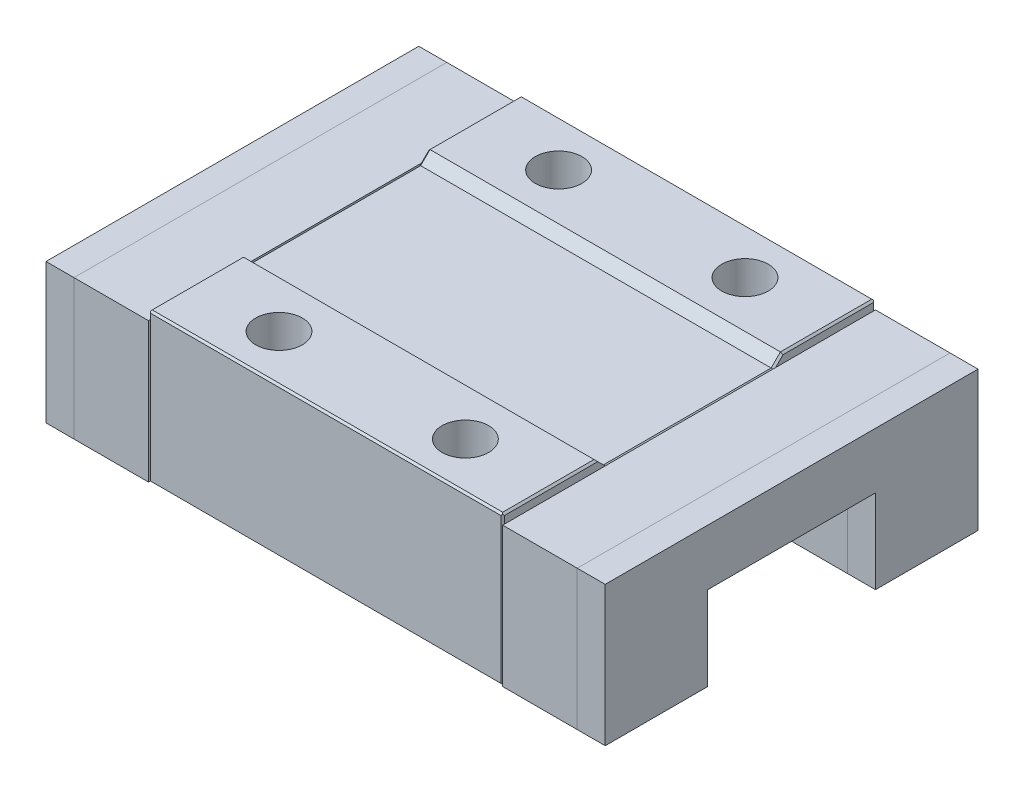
SolidWorks part; units mm, degrees
ref_plane "Ebene vorne" through (0, 0, 0) normal (0, 0, 1) x (1, 0, 0)
ref_plane "Ebene oben" through (0, 0, 0) normal (0, 1, 0) x (1, 0, 0)
ref_plane "Ebene rechts" through (0, 0, 0) normal (1, 0, 0) x (0, 0, -1)
sketch "Skizze1" plane through (0, 0, 0) normal (1, 0, 0) x (0, 0, -1)
  line L0 (0, 0) -> (0, -11.0826) construction
  line L1 (10, -4) -> (4.5, -4)
  line L2 (10, -4) -> (10, 4)
  line L3 (10, 4) -> (4.5, 4)
  line L4 (-10, -4) -> (-10, 4)
  line L5 (10, -4) -> (-10, 4) construction
  line L6 (10, 4) -> (-10, -4) construction
  line L7 (-4.5, -4) -> (-10, -4)
  line L8 (-4.5, 4) -> (-10, 4)
  line L9 (-4.5, -4) -> (-4.5, 0.5)
  line L10 (-4.5, 0.5) -> (4.5, 0.5)
  line L11 (4.5, -4) -> (4.5, 0.5)
  line L13 (4.5, 4) -> (4.5, 3.5)
  line L14 (4.5, 3.5) -> (-4.5, 3.5)
  line L15 (-4.5, 4) -> (-4.5, 3.5)
  point P0 (0, 0)
  dimension "D1" = 8
  dimension "D2" = 20
  dimension "D3" = 4.5
  dimension "D4" = 9
  dimension "D5" = 4.5
  dimension "D6" = 0.5
  dimension "D8" = 4.5
extrude "Aufsatz-Linear austragen1" add sketch "Skizze1" against normal blind 19
sketch "Skizze6" plane through (0, 4, 0) normal (0, 1, 0) x (1, 0, 0)
  line L0 (-9.5, 10) -> (-9.5, -10) construction
  line L1 (-14.5, 7.5) -> (-4.5, 7.5) construction
  line L2 (-14.5, 7.5) -> (-14.5, -7.5) construction
  line L3 (-14.5, -7.5) -> (-4.5, -7.5) construction
  line L4 (-4.5, 7.5) -> (-4.5, -7.5) construction
  line L5 (-19, 10) -> (0, 10) construction
  line L6 (-19, -10) -> (0, -10) construction
  point P12 (-14.5, 7.5)
  point P13 (-4.5, 7.5)
  point P14 (-4.5, -7.5)
  point P15 (-14.5, -7.5)
  dimension "D1" = 5
  dimension "D2" = 10
  dimension "D3" = 7.5
  dimension "D4" = 15
sketch "Skizze3" plane through (0, 0, 0) normal (1, 0, 0) x (0, 0, -1)
  line L0 (-4.5, 4) -> (-10, 4) construction
  line L12 (-4.5, 4) -> (-10, 4)
  line L13 (-10, 4) -> (-10, -4)
  line L14 (-10, -4) -> (-4.5, -4)
  line L15 (-4.5, -4) -> (-4.5, 0.5)
  line L16 (-4.5, 0.5) -> (4.5, 0.5)
  line L17 (4.5, 0.5) -> (4.5, -4)
  line L18 (4.5, -4) -> (10, -4)
  line L19 (10, -4) -> (10, 4)
  line L20 (10, 4) -> (4.5, 4)
  line L21 (4.5, 4) -> (4.5, 3.5)
  line L22 (4.5, 3.5) -> (-4.5, 3.5)
  line L23 (-4.5, 3.5) -> (-4.5, 4)
  line L24 (10, 3.5) -> (-10, 3.5)
  line L25 (-10, 3.5) -> (-10, -4)
  line L26 (-10, -4) -> (-4.5, -4)
  line L27 (-4.5, -4) -> (-4.5, 0.5)
  line L28 (-4.5, 0.5) -> (4.5, 0.5)
  line L29 (4.5, 0.5) -> (4.5, -4)
  line L30 (4.5, -4) -> (10, -4)
  line L31 (10, -4) -> (10, 3.5)
  dimension "D2" = 0.5
  dimension "D1" = 0
extrude "Aufsatz-Linear austragen5" add sketch "Skizze3" along normal blind 4 separate body
ref_plane "Ebene1" through (-9.5, 0, 0) normal (1, 0, 0) x (0, 0, -1)
sketch "Skizze8" plane through (-19, 0, 0) normal (-1, 0, 0) x (0, 0, 1)
  line L8 (10, 3.5) -> (-10, 3.5)
  line L9 (10, -4) -> (10, 3.5)
  line L10 (4.5, -4) -> (10, -4)
  line L11 (4.5, 0.5) -> (4.5, -4)
  line L12 (-4.5, 0.5) -> (4.5, 0.5)
  line L13 (-4.5, -4) -> (-4.5, 0.5)
  line L14 (-10, -4) -> (-4.5, -4)
  line L15 (-10, 3.5) -> (-10, -4)
  line L16 (10, 3.5) -> (-10, 3.5)
  line L17 (10, -4) -> (10, 3.5)
  line L18 (4.5, -4) -> (10, -4)
  line L19 (4.5, 0.5) -> (4.5, -4)
  line L20 (-4.5, 0.5) -> (4.5, 0.5)
  line L21 (-4.5, -4) -> (-4.5, 0.5)
  line L22 (-10, -4) -> (-4.5, -4)
  line L23 (-10, 3.5) -> (-10, -4)
  line L24 (10, 3.5) -> (-10, 3.5)
  line L25 (10, -4) -> (10, 3.5)
  line L26 (4.5, -4) -> (10, -4)
  line L27 (4.5, 0.5) -> (4.5, -4)
  line L28 (-4.5, 0.5) -> (4.5, 0.5)
  line L29 (-4.5, -4) -> (-4.5, 0.5)
  line L30 (-10, -4) -> (-4.5, -4)
  line L31 (-10, 3.5) -> (-10, -4)
  line L32 (10, 3.5) -> (-10, 3.5)
  line L33 (10, -4) -> (10, 3.5)
  line L34 (4.5, -4) -> (10, -4)
  line L35 (4.5, 0.5) -> (4.5, -4)
  line L36 (-4.5, 0.5) -> (4.5, 0.5)
  line L37 (-4.5, -4) -> (-4.5, 0.5)
  line L38 (-10, -4) -> (-4.5, -4)
  line L39 (-10, 3.5) -> (-10, -4)
  dimension "D1" = 0
  dimension "D2" = 0
extrude "Aufsatz-Linear austragen6" add sketch "Skizze8" along normal blind 4 separate body
chamfer "Fase6" distance 0.5 angle 45 2 edges at (-9.5, 4, 4.5) (-9.5, 4, -4.5)
hole_wizard "M3 Gewindebohrung1" positions "3D-Skizze1" profile "Skizze7" tap size "M3" standard "DIN"
sketch3d "3D-Skizze1"
  point P0 (-14.5, 4, -7.5)
  point P3 (-4.5, 4, -7.5)
  point P6 (-4.5, 4, 7.5)
  point P9 (-14.5, 4, 7.5)
sketch "Skizze7" plane through (-14.5, 4, -7.5) normal (1, 0, 0) x (0, 0, 1)
  line L0 (0, 0) -> (0, 6.7511)
  line L1 (0, 6.7511) -> (1.25, 6)
  line L2 (1.25, 6) -> (1.25, 0)
  line L5 (1.25, 0) -> (0, 0)
  line L10 (0, 6.7511) -> (-1.25, 6) construction
  line L11 (0, -6.35) -> (0, 107.95) construction
  dimension "Bohrerdurchmesser" = 2.5
  dimension "Bohrungstiefe" = 6
  dimension "Spitzenwinkel" = 118
chamfer "Fase7" distance 0.1 angle 45 8 edges at (-9.5, -4, 10) (-19, 0, 10) (-9.5, 4, 10) (0, 0, 10) (-9.5, 4, -10) (-19, 0, -10) (-9.5, -4, -10) (0, 0, -10)
chamfer "Fase8" distance 0.1 angle 45 9 edges at (0, -4, 7.2) (0, 4, 7.45) (0, 4, -7.45) (0, 3.75, -4.75) (0, 3.5, 0) (0, -4, -7.2) (0, -1.75, -4.5) (0, 0.5, 0) (0, -1.75, 4.5)
chamfer "Fase9" distance 0.1 angle 45 10 edges at (-19, -4, 7.2) (-19, -1.75, 4.5) (-19, 0.5, 0) (-19, -1.75, -4.5) (-19, -4, -7.2) (-19, 4, 7.45) (-19, 3.75, 4.75) (-19, 3.5, 0) (-19, 3.75, -4.75) (-19, 4, -7.45)
sketch "Skizze9" plane through (4, 0, 0) normal (1, 0, 0) x (0, 0, -1)
  line L8 (-10, 3.5) -> (-10, -4)
  line L9 (-10, -4) -> (-4.5, -4)
  line L10 (-4.5, -4) -> (-4.5, 0.5)
  line L11 (-4.5, 0.5) -> (4.5, 0.5)
  line L12 (4.5, 0.5) -> (4.5, -4)
  line L13 (4.5, -4) -> (10, -4)
  line L14 (10, -4) -> (10, 3.5)
  line L15 (10, 3.5) -> (-10, 3.5)
  line L16 (-10, 3.5) -> (-10, -4)
  line L17 (-10, -4) -> (-4.5, -4)
  line L18 (-4.5, -4) -> (-4.5, 0.5)
  line L19 (-4.5, 0.5) -> (4.5, 0.5)
  line L20 (4.5, 0.5) -> (4.5, -4)
  line L21 (4.5, -4) -> (10, -4)
  line L22 (10, -4) -> (10, 3.5)
  line L23 (10, 3.5) -> (-10, 3.5)
  dimension "D1" = 0
extrude "Aufsatz-Linear austragen7" add sketch "Skizze9" along normal blind 1.5 separate body
sketch "Skizze10" plane through (-23, 0, 0) normal (-1, 0, 0) x (0, 0, 1)
  line L8 (10, -4) -> (10, 3.5)
  line L9 (10, 3.5) -> (-10, 3.5)
  line L10 (-10, 3.5) -> (-10, -4)
  line L11 (-10, -4) -> (-4.5, -4)
  line L12 (-4.5, -4) -> (-4.5, 0.5)
  line L13 (-4.5, 0.5) -> (4.5, 0.5)
  line L14 (4.5, 0.5) -> (4.5, -4)
  line L15 (4.5, -4) -> (10, -4)
  line L16 (10, -4) -> (10, 3.5)
  line L17 (10, 3.5) -> (-10, 3.5)
  line L18 (-10, 3.5) -> (-10, -4)
  line L19 (-10, -4) -> (-4.5, -4)
  line L20 (-4.5, -4) -> (-4.5, 0.5)
  line L21 (-4.5, 0.5) -> (4.5, 0.5)
  line L22 (4.5, 0.5) -> (4.5, -4)
  line L23 (4.5, -4) -> (10, -4)
  dimension "D1" = 0
extrude "Aufsatz-Linear austragen8" add sketch "Skizze10" along normal blind 1.5 separate body
ref_plane "Mitte Lagerbock" through (-9.5, 0, 0) normal (1, 0, 0) x (0, 0, -1)
